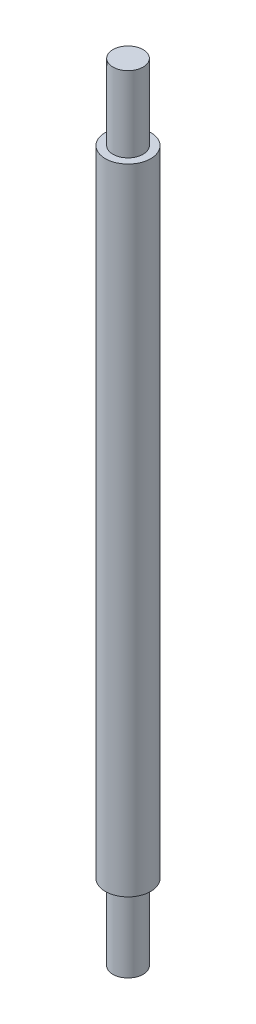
SolidWorks part; units mm, degrees
ref_plane "Front Plane" through (0, 0, 0) normal (0, 0, 1) x (1, 0, 0)
ref_plane "Top Plane" through (0, 0, 0) normal (0, 1, 0) x (1, 0, 0)
ref_plane "Right Plane" through (0, 0, 0) normal (1, 0, 0) x (0, 0, -1)
sketch "Sketch1" plane through (0, 0, 0) normal (0, 0, 1) x (1, 0, 0)
  line L0 (0, 0) -> (0, 120.3099) construction
  line L1 (0, 52) -> (0, -52)
  line L2 (0, 52) -> (2, 52)
  line L3 (2, 52) -> (2, 42)
  line L4 (2, 42) -> (3, 42)
  line L5 (3, 42) -> (3, -42)
  line L6 (3, -42) -> (2, -42)
  line L7 (2, -42) -> (2, -52)
  line L8 (2, -52) -> (0, -52)
  point P6 (0, 0)
  point P7 (2, 47)
  dimension "D1" = 104
  dimension "D2" = 10
  dimension "D3" = 10
  dimension "D4" = 2
  dimension "D5" = 3
revolve "Revolve1" add sketch "Sketch1" angle 360 about L0
